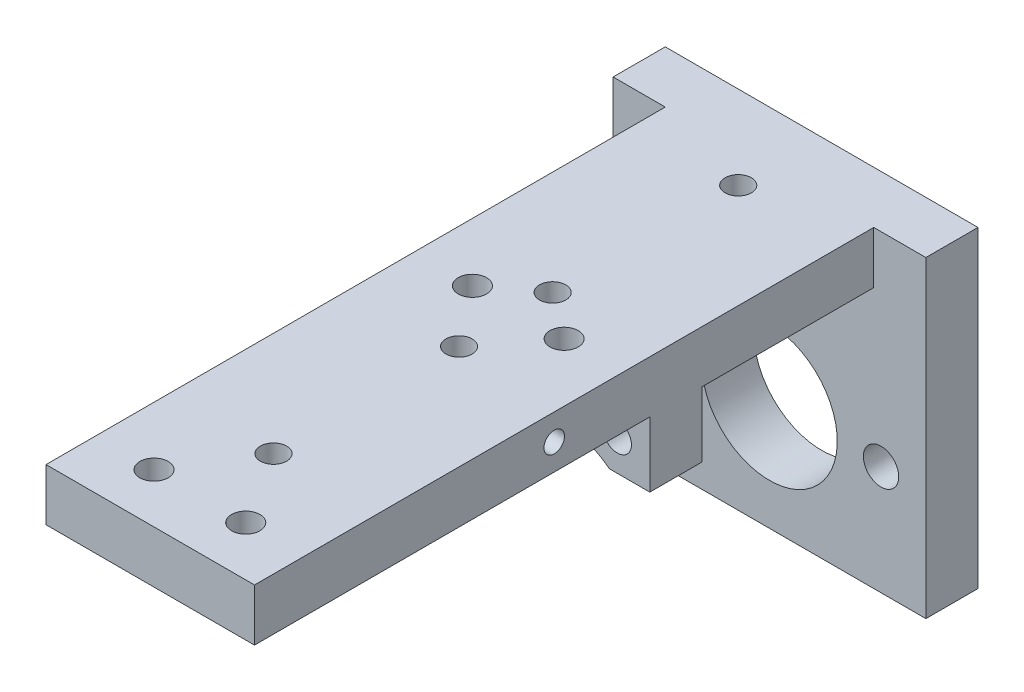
SolidWorks part; units mm, degrees
ref_plane "Front Plane" through (0, 0, 0) normal (0, 0, 1) x (1, 0, 0)
ref_plane "Top Plane" through (0, 0, 0) normal (0, 1, 0) x (1, 0, 0)
ref_plane "Right Plane" through (0, 0, 0) normal (1, 0, 0) x (0, 0, -1)
sketch "Sketch1" plane through (0, 0, 0) normal (1, 0, 0) x (0, 0, -1)
  line L0 (0, 0) -> (-81.788, 0)
  line L1 (0, 0) -> (0, -38.1)
  line L2 (-6.35, -6.35) -> (-81.788, -6.35)
  line L3 (-6.35, -6.35) -> (-6.35, -38.1)
  line L4 (-81.788, -6.35) -> (-81.788, 0)
  line L5 (-6.35, -38.1) -> (0, -38.1)
  dimension "D2" = 81.788
  dimension "D3" = 38.1
  dimension "D1" = 6.35
extrude "Extrude1" add sketch "Sketch1" along normal mid plane 38.1
sketch "Sketch2" plane through (0, 0, 0) normal (0, 0, -1) x (-1, 0, 0)
  line L0 (-19.05, 0) -> (19.05, 0) construction
  circle A0 centre (0, -24.7904) radius 8.255
  dimension "D2" = 16.51
  dimension "D1" = 24.7904
extrude "Cut-Extrude1" cut sketch "Sketch2" against normal up to next
hole_wizard "#8 Clearance Hole1" positions "3DSketch1" profile "Sketch3" hole size "#8" standard "Ansi Inch"
sketch3d "3DSketch1"
  line L0 (19.05, 0, 0) -> (-19.05, 0, 0) construction
  circle A0 centre (0, -24.7904, 0) radius 8.255 construction
  point P0 (13.589, -24.7904, 0)
  point P2 (-13.589, -24.7904, 0)
  point P11 (0, -24.7904, -8.255)
  dimension "D1" = 27.178
  dimension "D2" = 24.7904
  dimension "D3" = 13.589
sketch "Sketch3" plane through (13.589, -24.7904, 0) normal (1, 0, 0) x (0, 1, 0)
  line L0 (0, 0) -> (0, 37.8694)
  line L1 (0, 37.8694) -> (2.1526, 36.576)
  line L2 (2.1526, 36.576) -> (2.1526, 0)
  line L5 (2.1526, 0) -> (0, 0)
  line L10 (0, 37.8694) -> (-2.1527, 36.576) construction
  line L11 (0, -6.35) -> (0, 107.95) construction
  dimension "Hole Dia." = 4.3053
  dimension "Hole Depth" = 36.576
  dimension "Drill Angle" = 118
hole_wizard "CBORE for M3 SHCS2" positions "3DSketch3" profile "Sketch5" counterbore size "M3" standard "Ansi Metric"
sketch3d "3DSketch3"
  line L2 (-19.05, -6.35, 81.788) -> (-19.05, -6.35, 6.35) construction
  line L4 (19.05, -6.35, 6.35) -> (-19.05, -6.35, 6.35) construction
  point P0 (0, -6.35, 32.766)
  point P2 (0, -6.35, 66.7766)
  point P15 (0, -6.35, 10.16)
  point P17 (0, -6.35, 44.1706)
  dimension "D1" = 32.766
  dimension "D2" = 19.05
  dimension "D3" = 34.0106
  dimension "D4" = 3.81
  dimension "D5" = 37.8206
sketch "Sketch5" plane through (0, -6.35, 32.766) normal (1, 0, 0) x (0, 0, -1)
  line L0 (0, 0) -> (0, 6.35)
  line L1 (0, 6.35) -> (1.6, 6.35)
  line L3 (1.6, 6.35) -> (1.6, 3)
  line L4 (1.6, 3) -> (3.25, 3)
  line L5 (3.25, 3) -> (3.25, 0)
  line L7 (3.25, 0) -> (0, 0)
  line L11 (0, -6.35) -> (0, 107.95) construction
  dimension "Thru Hole Dia." = 3.2
  dimension "Thru Hole Depth" = 6.35
  dimension "C'Bore Dia." = 6.5
  dimension "C'Bore Depth" = 3
sketch "Sketch6" plane through (0, -6.35, 0) normal (0, -1, 0) x (1, 0, 0)
  line L0 (19.05, 6.35) -> (-19.05, 6.35) construction
  line L1 (19.05, 81.788) -> (12.7, 81.788)
  line L2 (19.05, 81.788) -> (19.05, 6.35)
  line L3 (19.05, 6.35) -> (12.7, 6.35)
  line L4 (12.7, 81.788) -> (12.7, 6.35)
  line L5 (19.05, 6.35) -> (-19.05, 6.35) construction
  line L6 (-19.05, 81.788) -> (-12.7, 81.788)
  line L7 (-19.05, 81.788) -> (-19.05, 6.35)
  line L8 (-19.05, 6.35) -> (-12.7, 6.35)
  line L9 (-12.7, 81.788) -> (-12.7, 6.35)
  dimension "D1" = 6.35
  dimension "D2" = 6.35
extrude "Cut-Extrude2" cut sketch "Sketch6" against normal through all
sketch "Sketch7" plane through (12.7, 0, 0) normal (1, 0, 0) x (0, 0, -1)
  line L0 (-81.788, -6.35) -> (-6.35, -6.35) construction
  line L1 (-27.2796, -6.35) -> (-33.6296, -6.35)
  line L2 (-27.2796, -6.35) -> (-27.2796, -14.2875)
  line L3 (-27.2796, -14.2875) -> (-33.6296, -14.2875)
  line L4 (-33.6296, -6.35) -> (-33.6296, -14.2875)
  line L5 (0, -38.1) -> (0, 0) construction
  dimension "D1" = 7.9375
  dimension "D2" = 6.35
  dimension "D3" = 33.6296
extrude "Extrude2" add sketch "Sketch7" against normal up to surface (25.4 mm away)
sketch "Sketch8" plane through (0, -14.2875, 0) normal (0, -1, 0) x (1, 0, 0)
  circle A0 centre (0, 32.766) radius 3.25
extrude "Cut-Extrude3" cut sketch "Sketch8" against normal up to next
hole_wizard "#8-32 Tapped Hole1" positions "3DSketch4" profile "Sketch9" tap size "#8-32" standard "Ansi Inch"
sketch3d "3DSketch4"
  line L0 (-12.7, -6.35, 33.6296) -> (-3.1332, -6.35, 33.6296) construction
  line L4 (-12.7, -14.2875, 33.6296) -> (-12.7, -6.35, 33.6296) construction
  line L5 (12.7, -6.35, 33.6296) -> (12.7, -14.2875, 33.6296) construction
  line L6 (3.1332, -6.35, 33.6296) -> (12.7, -6.35, 33.6296) construction
  point P0 (-8.7376, -10.414, 33.6296)
  point P2 (8.7376, -10.414, 33.6296)
  dimension "D1" = 4.064
  dimension "D2" = 3.9624
  dimension "D4" = 3.9624
  dimension "D3" = 4.064
sketch "Sketch9" plane through (-8.7376, -10.414, 33.6296) normal (1, 0, 0) x (0, -1, 0)
  line L0 (0, 0) -> (0, 13.3314)
  line L1 (0, 13.3314) -> (1.7272, 12.2936)
  line L2 (1.7272, 12.2936) -> (1.7272, 0)
  line L5 (1.7272, 0) -> (0, 0)
  line L10 (0, 13.3314) -> (-1.7272, 12.2936) construction
  line L11 (0, -6.35) -> (0, 107.95) construction
  dimension "Tap Drill Dia." = 3.4544
  dimension "Tap Drill Depth" = 12.2936
  dimension "Drill Angle" = 118
hole_wizard "#8-32 Tapped Hole2" positions "3DSketch5" profile "Sketch10" tap size "#8-32" standard "Ansi Inch"
sketch3d "3DSketch5"
  line L0 (19.05, 0, 0) -> (-19.05, 0, 0) construction
  line L1 (0, 0, 0) -> (0, 0, 81.788) construction
  line L2 (12.7, 0, 81.788) -> (-12.7, 0, 81.788) construction
  point P0 (-5.588, 0, 36.957)
  point P2 (5.588, 0, 36.957)
  point P4 (5.588, 0, 75.7428)
  point P6 (-5.588, 0, 75.7428)
  dimension "D1" = 36.957
  dimension "D2" = 38.7858
  dimension "D3" = 5.588
  dimension "D4" = 11.176
sketch "Sketch10" plane through (-5.588, 0, 36.957) normal (1, 0, 0) x (0, 0, 1)
  line L0 (0, 0) -> (0, 6.35)
  line L1 (0, 6.35) -> (1.7272, 6.35)
  line L2 (1.7272, 6.35) -> (1.7272, 0)
  line L5 (1.7272, 0) -> (0, 0)
  line L11 (0, -6.35) -> (0, 107.95) construction
  dimension "Thru Tap Drill Dia." = 3.4544
  dimension "Thru Tap Drill Depth" = 6.35
sketch "Sketch11" plane through (0, 0, 33.6296) normal (0, 0, 1) x (1, 0, 0)
  circle A0 centre (0, -24.7904) radius 13.081
  dimension "D1" = 26.162
extrude "Cut-Extrude4" cut sketch "Sketch11" against normal up to next
hole_wizard "M3x0.5 Tapped Hole1" positions "3DSketch6" profile "Sketch12" tap size "M3x0.5" standard "Ansi Metric"
sketch3d "3DSketch6"
  line L0 (19.05, -38.1, 0) -> (19.05, 0, 0) construction
  line L1 (12.7, 0, 81.788) -> (12.7, -6.35, 81.788) construction
  point P0 (12.7, -3.175, 45.2769)
  point P8 (12.7, -3.175, 81.788)
  dimension "D1" = 45.72
sketch "Sketch12" plane through (12.7, -3.175, 45.2769) normal (0, 1, 0) x (0, 0, -1)
  line L0 (0, 0) -> (0, 8.2441)
  line L1 (0, 8.2441) -> (1.25, 7.493)
  line L2 (1.25, 7.493) -> (1.25, 0)
  line L5 (1.25, 0) -> (0, 0)
  line L10 (0, 8.2441) -> (-1.25, 7.493) construction
  line L11 (0, -6.35) -> (0, 107.95) construction
  dimension "Tap Drill Dia." = 2.5
  dimension "Tap Drill Depth" = 7.493
  dimension "Drill Angle" = 118
hole_wizard "#8-32 Tapped Hole3" positions "3DSketch9" profile "Sketch15" tap size "#8-32" standard "Ansi Inch"
sketch3d "3DSketch9"
  line L0 (-19.05, 0, 0) -> (-19.05, 0, 6.35) construction
  line L1 (-19.05, -38.1, 0) -> (-19.05, 0, 0) construction
  point P0 (-19.05, -18.4404, 3.175)
  point P2 (-19.05, -31.1404, 3.175)
  dimension "D1" = 18.4404
  dimension "D2" = 3.175
  dimension "D3" = 12.7
sketch "Sketch15" plane through (-19.05, -18.4404, 3.175) normal (0, 1, 0) x (0, 0, 1)
  line L0 (0, 0) -> (0, 10.7188)
  line L1 (0, 10.7188) -> (1.7272, 10.7188)
  line L2 (1.7272, 10.7188) -> (1.7272, 0)
  line L5 (1.7272, 0) -> (0, 0)
  line L10 (0, 10.7188) -> (-1.7272, 10.7188) construction
  line L11 (0, -6.35) -> (0, 107.95) construction
  dimension "Tap Drill Dia." = 3.4544
  dimension "Tap Drill Depth" = 10.7188
  dimension "Drill Angle" = 180
